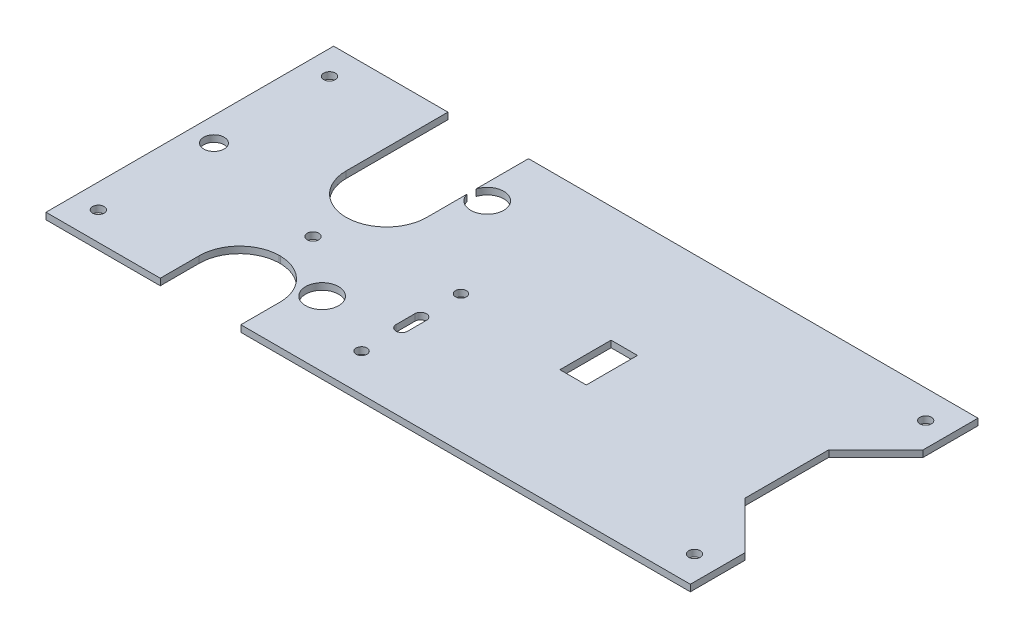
SolidWorks part; units mm, degrees
ref_plane "Plan de face" through (0, 0, 0) normal (0, 0, 1) x (1, 0, 0)
ref_plane "Plan de dessus" through (0, 0, 0) normal (0, 1, 0) x (1, 0, 0)
ref_plane "Plan de droite" through (0, 0, 0) normal (1, 0, 0) x (0, 0, -1)
sketch "Esquisse1" plane through (0, 0, 0) normal (0, 1, 0) x (1, 0, 0)
  line L0 (-89.4176, 41.7971) -> (-89.4176, -45.7029) construction
  line L1 (-89.4176, 41.7971) -> (-54.4176, 41.7971) construction
  line L2 (-89.4176, -45.7029) -> (-54.4176, -45.7029) construction
  line L3 (-54.4176, -33.7029) -> (-54.4176, -45.7029) construction
  line L4 (-30.4176, 10.7971) -> (-30.4176, 41.7971) construction
  line L5 (-30.4176, -45.7029) -> (-30.4176, -33.7029) construction
  line L6 (-30.4176, -45.7029) -> (106.0824, -45.7029) construction
  line L7 (106.0824, -45.7029) -> (106.0824, -28.8343) construction
  line L8 (91.7824, -14.5343) -> (106.0824, -28.8343) construction
  line L9 (91.7824, 10.6285) -> (91.7824, -14.5343) construction
  line L10 (106.0824, 24.9285) -> (91.7824, 10.6285) construction
  line L11 (106.0824, 24.9285) -> (106.0824, 41.7971) construction
  line L12 (-30.4176, 41.7971) -> (106.0824, 41.7971) construction
  line L13 (-54.4176, 41.7971) -> (-54.4176, 10.7971) construction
  line L14 (-54.6176, -33.7029) -> (-54.6176, -45.5029)
  line L15 (-81.9176, 33.0471) -> (98.5824, 33.0471) construction
  line L16 (-81.9176, 33.0471) -> (-81.9176, -36.9529) construction
  line L17 (-81.9176, -36.9529) -> (98.5824, -36.9529) construction
  line L18 (98.5824, 33.0471) -> (98.5824, -36.9529) construction
  line L19 (-89.2176, -45.5029) -> (-54.6176, -45.5029)
  line L20 (-89.2176, 41.5971) -> (-89.2176, -45.5029)
  line L21 (-89.2176, 41.5971) -> (-54.6176, 41.5971)
  line L22 (-54.6176, 41.5971) -> (-54.6176, 10.7971)
  line L23 (-30.2176, 10.7971) -> (-30.2176, 22.897)
  line L24 (-30.2176, 41.5971) -> (105.8824, 41.5971)
  line L25 (105.8824, 25.0113) -> (105.8824, 41.5971)
  line L26 (105.8824, 25.0113) -> (91.5824, 10.7113)
  line L27 (91.5824, 10.7113) -> (91.5824, -14.6171)
  line L28 (91.5824, -14.6171) -> (105.8824, -28.9171)
  line L29 (105.8824, -45.5029) -> (105.8824, -28.9171)
  line L30 (-30.2176, -45.5029) -> (105.8824, -45.5029)
  line L31 (-30.2176, -45.5029) -> (-30.2176, -33.7029)
  line L32 (-42.669, -21.5055) -> (-42.1662, -21.5055)
  line L33 (-42.6718, -1.4003) -> (-42.1634, -1.4003)
  line L34 (-89.4176, 41.7971) -> (-89.4176, -45.7029) construction
  line L35 (-89.4176, 41.7971) -> (-54.4176, 41.7971) construction
  line L36 (-89.4176, -45.7029) -> (-54.4176, -45.7029) construction
  line L37 (-54.4176, -33.7029) -> (-54.4176, -45.7029) construction
  line L38 (-30.4176, 10.7971) -> (-30.4176, 41.7971) construction
  line L39 (-30.4176, -45.7029) -> (-30.4176, -33.7029) construction
  line L40 (-30.4176, -45.7029) -> (106.0824, -45.7029) construction
  line L41 (106.0824, -45.7029) -> (106.0824, -28.8343) construction
  line L42 (91.7824, -14.5343) -> (106.0824, -28.8343) construction
  line L43 (91.7824, 10.6285) -> (91.7824, -14.5343) construction
  line L44 (106.0824, 24.9285) -> (91.7824, 10.6285) construction
  line L45 (106.0824, 24.9285) -> (106.0824, 41.7971) construction
  line L46 (-30.4176, 41.7971) -> (106.0824, 41.7971) construction
  line L47 (-54.4176, 41.7971) -> (-54.4176, 10.7971) construction
  line L48 (-20.4176, 29.2971) -> (-30.4176, 29.2971) construction
  line L49 (-20.4176, 19.2971) -> (-20.4176, 29.2971) construction
  line L50 (-30.4176, 19.2971) -> (-20.4176, 19.2971) construction
  line L51 (-30.4176, -30.7029) -> (-20.4176, -30.7029) construction
  line L52 (-30.4176, -20.7029) -> (-30.4176, -30.7029) construction
  line L53 (-20.4176, -20.7029) -> (-30.4176, -20.7029) construction
  line L54 (-20.4176, -30.7029) -> (-20.4176, -20.7029) construction
  line L55 (-30.4176, 29.2971) -> (-30.4176, 19.2971) construction
  line L56 (-25.4176, -20.7029) -> (-25.4176, -30.7029) construction
  line L57 (-25.4176, 29.2971) -> (-25.4176, 19.2971) construction
  line L58 (-30.2176, 25.6972) -> (-30.2176, 41.5971)
  line L60 (-30.2176, 10.7971) -> (-30.2176, 41.5971) construction
  line L61 (29.8824, 6.4971) -> (37.8824, 6.4971)
  line L62 (29.8824, 6.4971) -> (29.8824, -9.0029)
  line L63 (29.8824, -9.0029) -> (37.8824, -9.0029)
  line L64 (37.8824, 6.4971) -> (37.8824, -9.0029)
  line L65 (29.8824, 6.4971) -> (37.8824, -9.0029) construction
  line L66 (29.8824, -9.0029) -> (37.8824, 6.4971) construction
  line L67 (-0.1176, -37.5029) -> (-9.9176, -37.5029) construction
  line L68 (-0.1176, -37.5029) -> (-0.1176, -0.7029) construction
  line L69 (-0.1176, -0.7029) -> (-9.9176, -0.7029) construction
  line L70 (-9.9176, -37.5029) -> (-9.9176, -0.7029) construction
  line L71 (-0.1176, -37.5029) -> (-9.9176, -0.7029) construction
  line L72 (-0.1176, -0.7029) -> (-9.9176, -37.5029) construction
  line L73 (-5.0176, -0.7029) -> (-5.0176, -37.5029) construction
  line L74 (-5.0176, -5.7029) -> (-0.1176, -5.7029) construction
  line L75 (-5.0176, -32.5029) -> (-0.1176, -32.5029) construction
  line L76 (-5.0176, -16.2529) -> (-5.0176, -21.9529) construction
  line L77 (-3.2676, -16.2529) -> (-3.2676, -21.9529)
  line L78 (-6.7676, -16.2529) -> (-6.7676, -21.9529)
  arc A0 (-42.6649, -21.7055) -> (-54.4176, -33.7029) centre (-42.4176, -33.7029) ccw construction
  arc A1 (-30.4176, -33.7029) -> (-42.1703, -21.7055) centre (-42.4176, -33.7029) ccw construction
  arc A2 (-42.1676, -1.2003) -> (-30.4176, 10.7971) centre (-42.4176, 10.7971) ccw construction
  arc A3 (-54.4176, 10.7971) -> (-42.6676, -1.2003) centre (-42.4176, 10.7971) ccw construction
  circle A4 centre (-81.9176, 33.0471) radius 1.75
  circle A5 centre (-81.9176, -36.9529) radius 1.75
  circle A6 centre (-81.9176, -1.9529) radius 3.1
  circle A7 centre (-42.4176, -11.4529) radius 1.75
  circle A8 centre (98.5824, -36.9529) radius 1.75
  circle A9 centre (98.5824, 33.0471) radius 1.75
  arc A10 (-42.669, -21.5055) -> (-54.6176, -33.7029) centre (-42.4176, -33.7029) ccw
  arc A11 (-54.6176, 10.7971) -> (-42.6718, -1.4003) centre (-42.4176, 10.7971) ccw
  arc A12 (-42.1634, -1.4003) -> (-30.2176, 10.7971) centre (-42.4176, 10.7971) ccw
  arc A13 (-30.2176, -33.7029) -> (-42.1662, -21.5055) centre (-42.4176, -33.7029) ccw
  arc A14 (-42.6649, -21.7054) -> (-54.4176, -33.7029) centre (-42.4176, -33.7029) ccw construction
  arc A15 (-30.4176, -33.7029) -> (-42.1704, -21.7054) centre (-42.4176, -33.7029) ccw construction
  arc A16 (-42.1676, -1.2003) -> (-30.4176, 10.7971) centre (-42.4176, 10.7971) ccw construction
  arc A17 (-54.4176, 10.7971) -> (-42.6676, -1.2003) centre (-42.4176, 10.7971) ccw construction
  circle A18 centre (-81.9176, 33.0471) radius 1.475 construction
  circle A19 centre (-81.9176, -36.9529) radius 1.475 construction
  circle A20 centre (-81.9176, -1.9529) radius 3 construction
  circle A21 centre (-42.4176, -11.4529) radius 1.475 construction
  circle A22 centre (98.5824, -36.9529) radius 1.475 construction
  circle A23 centre (98.5824, 33.0471) radius 1.475 construction
  circle A25 centre (-25.4176, -25.7029) radius 5
  arc A26 (-30.2176, 22.897) -> (-30.2176, 25.6972) centre (-25.4176, 24.2971) ccw
  circle A27 centre (-5.0176, -4.0529) radius 1.65
  circle A28 centre (-5.0176, -34.1529) radius 1.65
  arc A29 (-3.2676, -16.2529) -> (-6.7676, -16.2529) centre (-5.0176, -16.2529) ccw
  arc A30 (-6.7676, -21.9529) -> (-3.2676, -21.9529) centre (-5.0176, -21.9529) ccw
  point P109 (33.8824, -1.2529)
  point P118 (-5.0176, -19.1029)
  point P137 (-5.0176, -19.1029)
  point P142 (-5.0176, -14.5029)
  point P143 (-5.0176, -23.7029)
extrude "Boss.-Extru.1" add sketch "Esquisse1" along normal blind 2 contours A26 L23 A12 L33 A11 L22 L21 L20 L19 L14 A10 L32 A13 L31 L30 L29 L28 L27 L26 L25 L24 L58 A30 L78 A29 L77 A28 A27 A25 A9 A8 A7 A6 A5 A4 L61 L64 L63 L62
equation "\"D2@Esquisse1\"=\"D1@Esquisse1\""
equation "\"D4@Esquisse1\"=\"D1@Esquisse1\""
equation "\"D5@Esquisse1\"=\"D1@Esquisse1\""
equation "\"D3@Esquisse1\"=\"D1@Esquisse1\""
equation "\"D19@Esquisse1\"=\"D18@Esquisse1\""
equation "\"D21@Esquisse1\"=\"D20@Esquisse1\""
